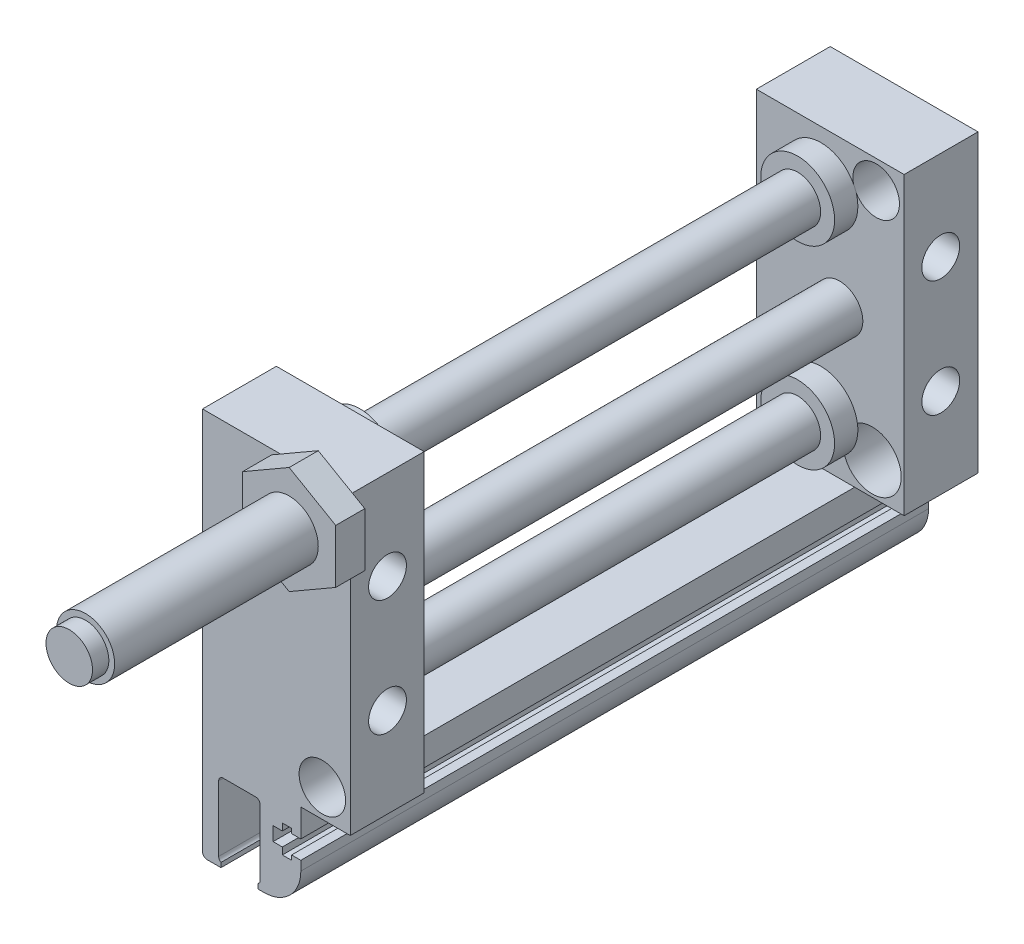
SolidWorks part; units mm, degrees
ref_plane "Front" through (0, 0, 0) normal (0, 0, 1) x (1, 0, 0)
ref_plane "Top" through (0, 0, 0) normal (0, 1, 0) x (1, 0, 0)
ref_plane "Right" through (0, 0, 0) normal (1, 0, 0) x (0, 0, -1)
ref_plane "Plane3-EEE" through (-6.3, 0, 0) normal (1, 0, 0) x (0, 0, -1)
sketch "Sketch1" plane through (0, 0, -12.699) normal (0, 0, 1) x (1, 0, 0)
  line L0 (11.1, -25.4) -> (11.1, 25.4) construction
  line L1 (11.1, -25.4) -> (-14.3, -25.4) construction
  line L2 (-14.3, -25.4) -> (-14.3, 25.4) construction
  line L3 (11.1, 25.4) -> (-14.3, 25.4) construction
  line L4 (11.1, -25.4) -> (11.1, 25.4)
  line L5 (11.1, -25.4) -> (-14.3, -25.4)
  line L6 (-14.3, -25.4) -> (-14.3, 25.4)
  line L7 (11.1, 25.4) -> (-14.3, 25.4)
extrude "Base-Extrude" add sketch "Sketch1" along normal up to surface (12.699 mm away)
sketch "Sketch5" plane through (-3.2, 0, 0) normal (1, 0, 0) x (0, 0, -1)
  line L0 (16.4651, 20.6) -> (91.201, 20.6)
  line L1 (91.201, 23) -> (95.201, 23)
  line L2 (91.201, 23) -> (91.201, 20.6)
  line L3 (12.699, 16.65) -> (46.699, 16.65) construction
  line L4 (95.201, 23) -> (95.201, 16.65)
  line L5 (12.699, 23) -> (15.9651, 23)
  line L6 (12.699, 23) -> (12.699, 16.65)
  line L7 (12.699, 16.65) -> (95.201, 16.65)
  line L9 (16.4651, 20.6) -> (15.9651, 20.6)
  line L10 (15.9651, 20.6) -> (15.9651, 23)
  dimension "D1" = 0.5
revolve "Boss-Revolve1" add sketch "Sketch5" angle 360 about L3
sketch "Sketch3" plane through (0, 0, -95.201) normal (0, 0, 1) x (1, 0, 0)
  line L0 (11.1, -25.4) -> (11.1, 25.4) construction
  line L1 (11.1, -25.4) -> (-14.3, -25.4) construction
  line L2 (-14.3, -25.4) -> (-14.3, 25.4) construction
  line L3 (11.1, 25.4) -> (-14.3, 25.4) construction
  line L4 (11.1, -25.4) -> (11.1, 25.4)
  line L5 (11.1, -25.4) -> (-14.3, -25.4)
  line L6 (-14.3, -25.4) -> (-14.3, 25.4)
  line L7 (11.1, 25.4) -> (-14.3, 25.4)
extrude "Boss-Extrude2" add sketch "Sketch3" against normal up to surface (12.699 mm away)
sketch "Sketch4" plane through (0, 0, -12.699) normal (0, 0, -1) x (-1, 0, 0)
  circle A0 centre (0, 0) radius 4
  circle A1 centre (0, 0) radius 4 construction
extrude "Boss-Extrude3" add sketch "Sketch4" along normal up to surface (82.502 mm away)
sketch "Sketch6" plane through (-3.2, 0, 0) normal (1, 0, 0) x (0, 0, -1)
  line L0 (20.997, -16.65) -> (143.1072, -16.65) construction
  line L1 (12.699, -16.65) -> (46.699, -16.65) construction
  line L2 (12.699, -16.65) -> (95.201, -16.65)
  line L3 (12.699, 25.4) -> (12.699, -25.4) construction
  line L4 (95.201, -16.65) -> (95.201, -10.3)
  line L5 (95.201, -10.3) -> (91.201, -10.3)
  line L6 (91.201, -10.3) -> (91.201, -12.7)
  line L7 (91.201, 25.4) -> (91.201, -25.4) construction
  line L8 (91.201, -12.7) -> (16.699, -12.7)
  line L10 (16.199, -10.3) -> (12.699, -10.3)
  line L11 (12.699, -10.3) -> (12.699, -16.65)
  line L12 (16.699, -12.7) -> (16.199, -12.7)
  line L13 (16.199, -12.7) -> (16.199, -10.3)
  dimension "D1" = 0.5
revolve "Boss-Revolve2" add sketch "Sketch6" angle 360 about L0
sketch "Sketch8" plane through (0, 0, 0) normal (0, 0, 1) x (1, 0, 0)
  circle A0 centre (6.3, -20.6) radius 4
  circle A2 centre (6.3, -20.6) radius 4 construction
extrude "M8X1.25(BB)" cut sketch "Sketch8" against normal up to surface (12.699 mm away)
sketch "Sketch16" plane through (0, 0, -107.9) normal (0, 0, -1) x (-1, 0, 0)
  circle A0 centre (-6.3, 20.6) radius 4
  circle A1 centre (-6.3, -20.6) radius 4 construction
extrude "M8X1.25(BB1)" cut sketch "Sketch16" against normal up to surface (12.699 mm away)
ref_plane "Plane1-CBORE" through (4.8, 0, 0) normal (1, 0, 0) x (0, 0, -1)
sketch "Sketch11" plane through (0, 0, -107.9) normal (0, 0, -1) x (-1, 0, 0)
  line L0 (7.95, -58.0421) -> (7.95, -71.817) construction
  line L1 (-6.624, -31.75) -> (-15.5114, -31.75) construction
  line L3 (-11.1, -25.4) -> (14.3, -25.4) construction
  line L4 (-2.6, -25.4) -> (-2.6, -41.3) construction
  line L5 (-2.6, -41.3) -> (14.3, -41.3) construction
  line L6 (14.3, -41.3) -> (14.3, -25.4) construction
  line L22 (-2.6, -25.4) -> (14.3, -25.4)
  line L23 (-2.6, -25.4) -> (-2.6, -30.1625)
  line L24 (-2.6, -30.1625) -> (-1.012, -30.1625)
  line L25 (-1.012, -30.1625) -> (-1.012, -29.3685)
  line L26 (-1.012, -29.3685) -> (0.576, -29.3685)
  line L27 (0.576, -29.3685) -> (0.576, -30.5595)
  line L28 (0.576, -30.5595) -> (2.163, -30.5595)
  line L29 (2.163, -30.5595) -> (2.163, -32.9405)
  line L30 (2.163, -32.9405) -> (0.576, -32.9405)
  line L31 (0.576, -32.9405) -> (0.576, -34.1315)
  line L32 (0.576, -34.1315) -> (-1.012, -34.1315)
  line L33 (-1.012, -34.1315) -> (-1.012, -33.3375)
  line L34 (-1.012, -33.3375) -> (-2.6, -33.3375)
  line L35 (-2.6, -33.3375) -> (-2.6, -34.95)
  line L36 (4.775, -41.3) -> (3.75, -41.3)
  line L37 (4.775, -41.3) -> (4.775, -40.513)
  line L38 (4.378, -28.575) -> (4.378, -39.8254)
  line L39 (5.172, -27.781) -> (10.728, -27.781)
  line L40 (11.522, -28.575) -> (11.522, -39.8254)
  line L41 (11.125, -40.513) -> (11.125, -41.3)
  line L42 (11.125, -41.3) -> (13.506, -41.3)
  line L43 (14.3, -25.4) -> (14.3, -40.506)
  arc A6 (-2.6, -34.95) -> (3.75, -41.3) centre (3.75, -34.95) ccw
  arc A7 (4.378, -39.8254) -> (4.775, -40.513) centre (5.172, -39.8254) ccw
  arc A8 (5.172, -27.781) -> (4.378, -28.575) centre (5.172, -28.575) ccw
  arc A9 (11.522, -28.575) -> (10.728, -27.781) centre (10.728, -28.575) ccw
  arc A10 (11.125, -40.513) -> (11.522, -39.8254) centre (10.728, -39.8254) ccw
  arc A11 (13.506, -41.3) -> (14.3, -40.506) centre (13.506, -40.506) ccw
  dimension "D12" = 0.794
  dimension "D13" = 0.794
  dimension "D15" = 6.35
  dimension "D2" = 2.381
  dimension "D3" = 4.763
  dimension "D4" = 3.175
  dimension "D6" = 1.588
  dimension "D7" = 4.763
  dimension "D8" = 6.35
  dimension "D10" = 6.35
  dimension "D11" = 2.381
  dimension "D14" = 0.787
  dimension "D16" = 6.35
  dimension "D17" = 1.588
  dimension "D18" = 7.144
extrude "Boss-Extrude4" add sketch "Sketch11" against normal up to surface (107.9 mm away)
sketch "Sketch25" plane through (0, 0, 0) normal (0, 0, 1) x (1, 0, 0)
  circle A0 centre (5.6, 19.9) radius 5
  circle A1 centre (5.6, 19.9) radius 5 construction
extrude "M10X1(CC)" cut sketch "Sketch25" against normal up to surface (12.699 mm away)
sketch "Sketch26" plane through (0, 0, -107.9) normal (0, 0, -1) x (-1, 0, 0)
  circle A0 centre (-5.6, -19.9) radius 5
  circle A1 centre (-5.6, -19.9) radius 5 construction
extrude "M10X1(CC1)" cut sketch "Sketch26" against normal up to surface (12.699 mm away)
sketch "Sketch12" plane through (5.6, 0, 0) normal (1, 0, 0) x (0, 0, -1)
  line L0 (-42.8, 19.9) -> (2.7, 19.9) construction
  line L1 (-40, 24.9) -> (2.7, 24.9) construction
  line L6 (2.7, 19.9) -> (2.7, 24.9) construction
  line L7 (-40, 24.9) -> (-40, 23.9) construction
  line L8 (-40, 23.9) -> (-42.8, 23.9) construction
  line L9 (-42.8, 23.9) -> (-42.8, 19.9) construction
  line L10 (-42.8, 19.9) -> (2.7, 19.9)
  line L11 (-40, 24.9) -> (2.7, 24.9)
  line L12 (2.7, 19.9) -> (2.7, 24.9)
  line L17 (-40, 24.9) -> (-40, 23.9)
  line L18 (-40, 23.9) -> (-42.8, 23.9)
  line L19 (-42.8, 23.9) -> (-42.8, 19.9)
  line L22 (-42.1702, 19.9) -> (-42.8, 19.9) construction
  line L23 (-42.8, 19.9) -> (-54.3695, 19.9) construction
revolve "ADJUSTMENT1" add sketch "Sketch12" angle 360 about L22
sketch "Sketch17" plane through (0, -27.781, 0) normal (0, -1, 0) x (1, 0, 0)
  line L0 (-7.95, -98.35) -> (-5.9655, -98.35) construction
  line L1 (-7.95, -98.35) -> (-40.6517, -98.35) construction
  line L2 (-7.95, -9.55) -> (-45.922, -9.55) construction
  line L3 (11.1, 0) -> (-14.3, 0) construction
  line L4 (-7.95, -98.35) -> (-7.95, -124.2252) construction
  line L5 (11.1, -107.9) -> (2.6, -107.9) construction
  circle A0 centre (-7.95, -98.35) radius 1.9845
  circle A1 centre (-7.95, -9.55) radius 1.9845
  dimension "D1" = 3.969
  dimension "D2" = 9.55
  dimension "D3" = 9.55
extrude "Boss-Extrude7" add sketch "Sketch17" along normal blind 3.969
hole_wizard "M4x0.7 Tapped Hole1" positions "Sketch31" profile "Sketch30" tap size "M4x0.7" standard "Ansi Metric"
sketch "Sketch31" plane through (-14.3, 0, 0) normal (-1, 0, 0) x (0, 0, 1)
  point P0 (-101.5, 10)
  point P1 (-6.4, 10)
  point P2 (-6.4, -10)
  point P3 (-101.5, -10)
sketch "Sketch30" plane through (-14.3, 10, -101.5) normal (0, 1, 0) x (0, 0, 1)
  line L0 (0, 0) -> (0, 12.4914)
  line L1 (0, 12.4914) -> (1.65, 11.5)
  line L2 (1.65, 11.5) -> (1.65, 8)
  line L3 (1.65, 8) -> (2, 8)
  line L4 (2, 8) -> (2, 0)
  line L5 (2, 0) -> (0, 0)
  line L6 (142.6272, 8) -> (60.3728, 8) construction
  line L10 (0, 12.4914) -> (-1.65, 11.5) construction
  line L11 (0, -6.35) -> (0, 107.95) construction
  dimension "Tap Drill Dia." = 3.3
  dimension "Tap Drill Depth" = 11.5
  dimension "Thread Dia." = 4
  dimension "Drill Angle" = 118
hole_wizard "CBORE for M3 SHCS1"
sketch "Sketch33"
  point P0 (6.4, 10)
  point P2 (6.4, -10)
  point P3 (101.5, -10)
  point P4 (101.5, 10)
extrude "Boss-Extrude8" add sketch "Sketch22" along normal up to surface (5 mm away)
sketch "Sketch22" plane through (0, 0, 0) normal (0, 0, 1) x (1, 0, 0)
  line L1 (-2.4, 15.2812) -> (5.6, 10.6624)
  line L2 (5.6, 10.6624) -> (13.6, 15.2812)
  line L3 (13.6, 15.2812) -> (13.6, 24.5188)
  line L4 (13.6, 24.5188) -> (5.6, 29.1376)
  line L5 (5.6, 29.1376) -> (-2.4, 24.5188)
  line L6 (-2.4, 24.5188) -> (-2.4, 15.2812)
  line L7 (11.1, -25.4) -> (11.1, 25.4) construction
  circle A0 centre (5.6, 19.9) radius 8 construction
  dimension "D1" = 16
sketch "Sketch32" plane through (11.1, 10, -6.4) normal (0, 1, 0) x (0, 0, -1)
  line L0 (0, 0) -> (0, 19.0215)
  line L1 (0, 19.0215) -> (1.7, 18)
  line L2 (1.7, 18) -> (1.7, 6.3)
  line L3 (1.7, 6.3) -> (3.25, 6.3)
  line L4 (3.25, 6.3) -> (3.25, 0)
  line L5 (3.25, 0) -> (0, 0)
  line L6 (-56.4, 6.3) -> (43.6, 6.3) construction
  line L10 (0, 19.0215) -> (-1.7, 18) construction
  line L11 (0, -6.35) -> (0, 107.95) construction
  dimension "Hole Dia." = 3.4
  dimension "Hole Depth" = 18
  dimension "C'Bore Dia." = 6.5
  dimension "Drill Angle" = 118
ref_plane "Plane1" through (0, 0, 5) normal (0, 0, 1) x (1, 0, 0)
ref_plane "Plane2" through (0, 0, -112.9) normal (0, 0, 1) x (1, 0, 0)
